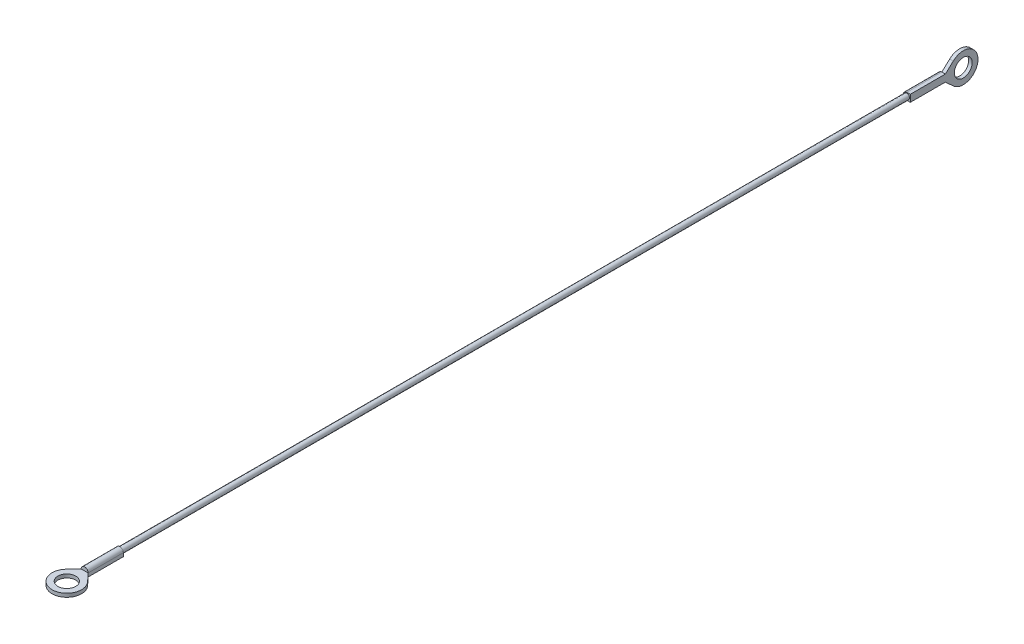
SolidWorks part; units mm, degrees
ref_plane "Front Plane" through (0, 0, 0) normal (0, 0, 1) x (1, 0, 0)
ref_plane "Top Plane" through (0, 0, 0) normal (0, 1, 0) x (1, 0, 0)
ref_plane "Right Plane" through (0, 0, 0) normal (1, 0, 0) x (0, 0, -1)
sketch "Sketch1" plane through (0, 0, 0) normal (0, 0, 1) x (1, 0, 0)
  circle A0 centre (0, 0) radius 0.795
extrude "Boss-Extrude1" add sketch "Sketch1" along normal mid plane 223.84
sketch "Sketch2" plane through (0, 0, 111.92) normal (0, 0, 1) x (1, 0, 0)
  line L0 (-0.995, 0) -> (-0.995, -0.995)
  line L1 (-0.995, -0.995) -> (0, -0.995)
  line L2 (0, -0.995) -> (0.995, -0.995)
  line L3 (0.995, -0.995) -> (0.995, 0)
  arc A0 (0.995, 0) -> (-0.995, 0) centre (0, 0) ccw
  dimension "D1" = 1.99
extrude "Boss-Extrude2" add sketch "Sketch2" along normal blind 10
sketch "Sketch3" plane through (0, -0.995, 0) normal (0, -1, 0) x (1, 0, 0)
  line L0 (0.995, 121.92) -> (3.0665, 124.1447)
  line L1 (-3.0665, 124.1447) -> (-0.995, 121.92)
  line L2 (-0.995, 121.92) -> (0.995, 121.92)
  arc A0 (3.0665, 124.1447) -> (-3.0665, 124.1447) centre (0, 127) ccw
  circle A1 centre (0, 127) radius 2.54
  point P8 (4.19, 127)
  point P9 (-4.19, 127)
  dimension "D1" = 5.08
  dimension "D2" = 8.38
  dimension "D3" = 127
extrude "Boss-Extrude3" add sketch "Sketch3" against normal blind 1.01
sketch "Sketch4" plane through (0, 0, -111.92) normal (0, 0, -1) x (-1, 0, 0)
  line L0 (0, 0.995) -> (-0.995, 0.995)
  line L1 (-0.995, 0.995) -> (-0.995, 0)
  line L2 (-0.995, 0) -> (-0.995, -0.995)
  line L3 (-0.995, -0.995) -> (0, -0.995)
  arc A0 (0, -0.995) -> (0, 0.995) centre (0, 0) ccw
  dimension "D1" = 1.99
extrude "Boss-Extrude4" add sketch "Sketch4" along normal blind 10
sketch "Sketch5" plane through (0.995, 0, 0) normal (1, 0, 0) x (0, 0, -1)
  line L0 (121.92, -0.995) -> (121.92, 0.995)
  line L1 (121.92, 0.995) -> (124.1447, 3.0665)
  line L2 (124.1447, -3.0665) -> (121.92, -0.995)
  arc A0 (124.1447, 3.0665) -> (124.1447, -3.0665) centre (127, 0) cw
  circle A1 centre (127, 0) radius 2.54
  point P8 (127, 4.19)
  point P9 (127, -4.19)
  dimension "D1" = 5.08
  dimension "D2" = 8.38
  dimension "D3" = 127
extrude "Boss-Extrude5" add sketch "Sketch5" against normal blind 1.01
